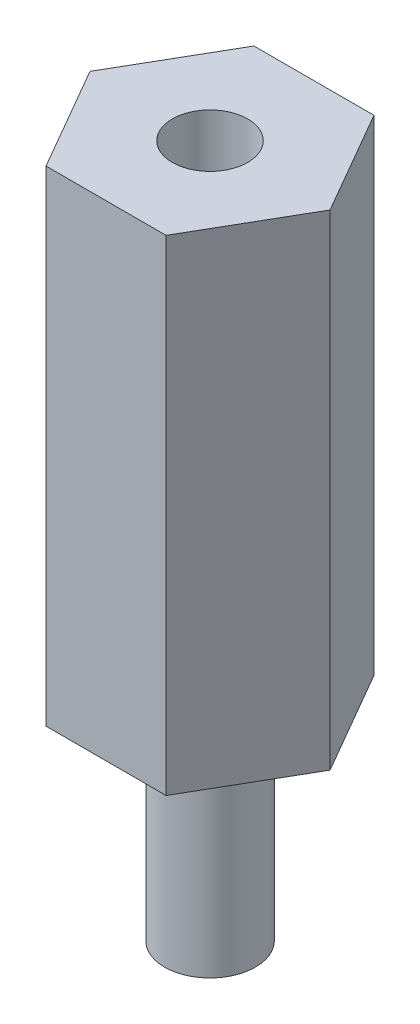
SolidWorks part; units mm, degrees
ref_plane "Front" through (0, 0, 0) normal (0, 0, 1) x (1, 0, 0)
ref_plane "Top" through (0, 0, 0) normal (0, 1, 0) x (1, 0, 0)
ref_plane "Right" through (0, 0, 0) normal (1, 0, 0) x (0, 0, -1)
sketch "Sketch1" plane through (0, 0, 0) normal (0, 1, 0) x (1, 0, 0)
  line L1 (5.4993, 0) -> (2.7496, 4.7625)
  line L2 (2.7496, 4.7625) -> (-2.7496, 4.7625)
  line L3 (-2.7496, 4.7625) -> (-5.4993, 0)
  line L4 (-5.4993, 0) -> (-2.7496, -4.7625)
  line L5 (-2.7496, -4.7625) -> (2.7496, -4.7625)
  line L6 (2.7496, -4.7625) -> (5.4993, 0)
  circle A1 centre (0, 0) radius 4.7625 construction
  dimension "D1" = 9.525
extrude "Base-Extrude" add sketch "Sketch1" along normal blind 22.225
sketch "Sketch2" plane through (0, 0, 0) normal (0, -1, 0) x (1, 0, 0)
  circle A0 centre (0, 0) radius 2.0828
  dimension "D1" = 4.1656
extrude "Extrude1" add sketch "Sketch2" along normal blind 9.525
hole_wizard "#8-32 Tapped Hole1" positions "Sketch4" profile "Sketch3" tap size "#8-32" standard "Ansi Inch"
sketch "Sketch4" plane through (0, 22.225, 0) normal (0, 1, 0) x (-1, 0, 0)
  point P0 (0, 0)
sketch "Sketch3" plane through (0, 22.225, 0) normal (1, 0, 0) x (0, 0, 1)
  line L0 (0, 0) -> (0, 14.9062)
  line L1 (0, 14.9062) -> (1.7272, 13.8684)
  line L2 (1.7272, 13.8684) -> (1.7272, 0)
  line L5 (1.7272, 0) -> (0, 0)
  line L10 (0, 14.9062) -> (-1.7272, 13.8684) construction
  line L11 (0, -6.35) -> (0, 107.95) construction
  dimension "Tap Drill Dia." = 3.4544
  dimension "Tap Drill Depth" = 13.8684
  dimension "Drill Angle" = 118
